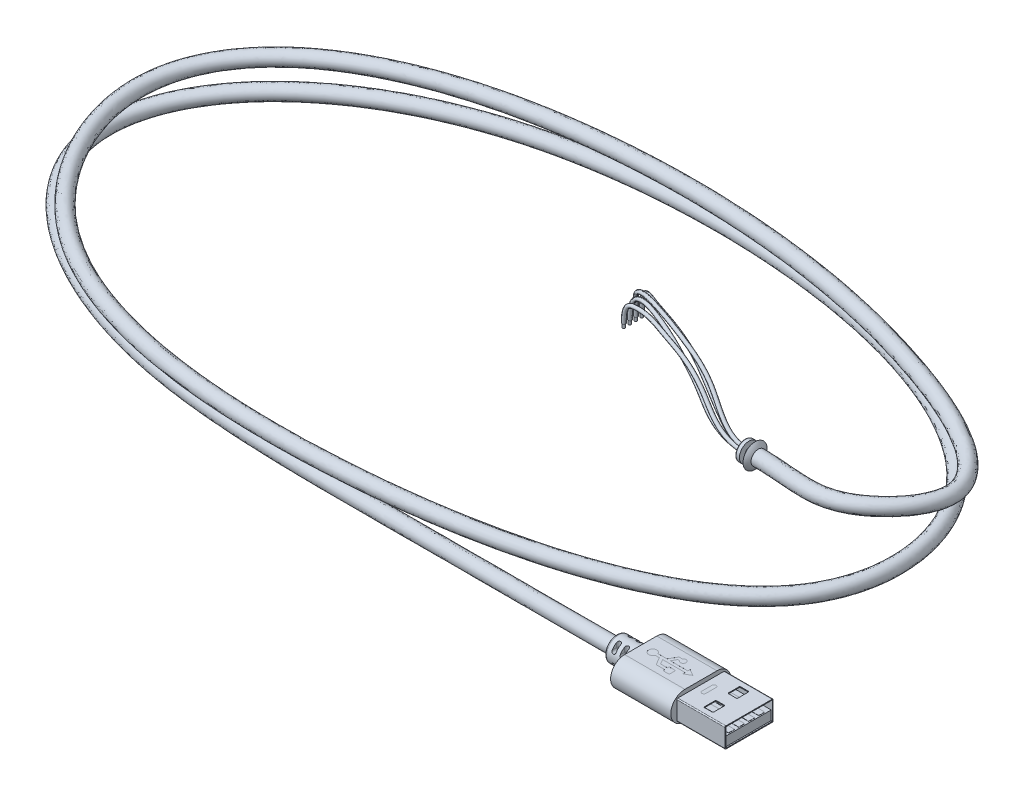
SolidWorks part; units mm, degrees
ref_plane "Спереди" through (0, 0, 0) normal (0, 0, 1) x (1, 0, 0)
ref_plane "Сверху" through (0, 0, 0) normal (0, 1, 0) x (1, 0, 0)
ref_plane "Справа" through (0, 0, 0) normal (1, 0, 0) x (0, 0, -1)
body saved out of another part "Заготовка-Дет1-1"
